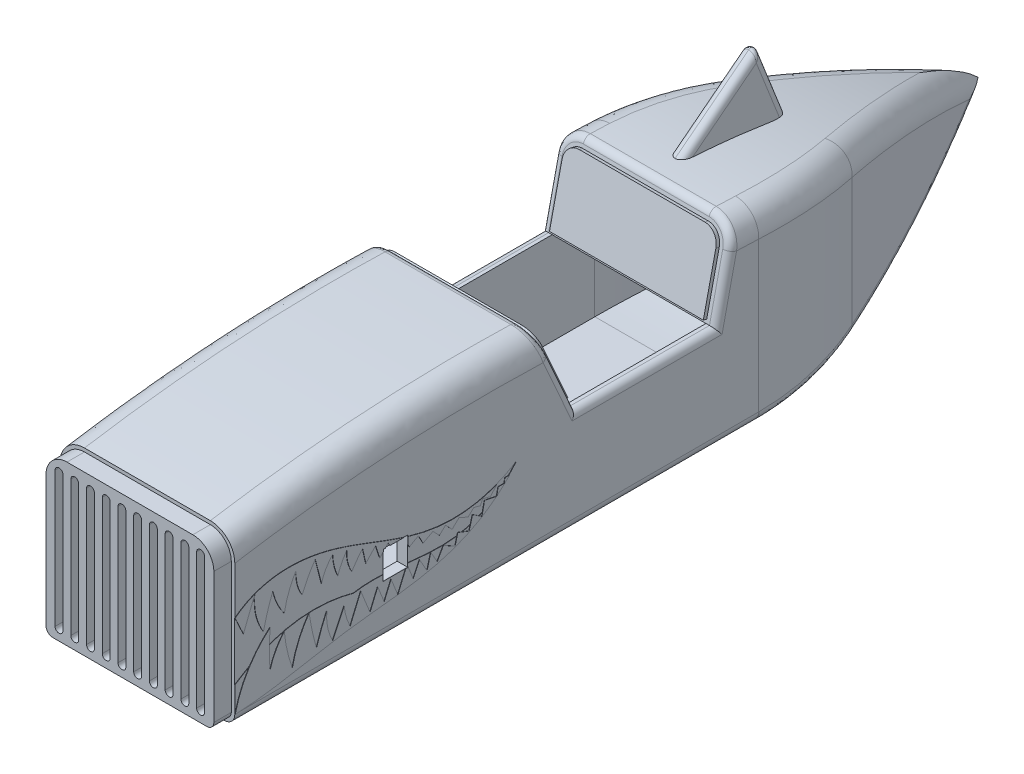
SolidWorks part; units mm, degrees
ref_plane "Front Plane" through (0, 0, 0) normal (0, 0, 1) x (1, 0, 0)
ref_plane "Top Plane" through (0, 0, 0) normal (0, 1, 0) x (1, 0, 0)
ref_plane "Right Plane" through (0, 0, 0) normal (1, 0, 0) x (0, 0, -1)
sketch "Sketch2" plane through (0, 0, 0) normal (1, 0, 0) x (0, 0, -1)
  line L0 (224.917, 170.9722) -> (330.4726, -65.1389)
  line L1 (330.4726, -65.1389) -> (730.4726, -65.1389)
  line L2 (730.4726, -65.1389) -> (783.2504, 170.9722)
  line L4 (330.4726, -359.5834) -> (-647.3052, -359.5834)
  line L5 (-647.3052, -359.5834) -> (-647.3052, 115.4166)
  line L6 (330.4726, -359.5834) -> (852.6948, -359.5834)
  spline S0 degree 2 poles (-647.3052, 115.4166) (-214.8464, 185.17) (224.917, 170.9722) knots 0 0 0 1 1 1
  spline S1 degree 2 poles (783.2504, 170.9722) (1291.8331, 158.9521) (1758.0173, -46.9169) knots 0 0 0 1 1 1
  spline S3 degree 2 poles (852.6948, -359.5834) (1369.0597, -360.7617) (1758.0173, -46.9169) knots 0 0 0 1 1 1
  dimension "D1" = 400
  dimension "D2" = 558.3333
  dimension "D4" = 2405.3225
  dimension "D5" = 475
extrude "Boss-Extrude2" add sketch "Sketch2" along normal blind 250
sketch "Sketch4" plane through (0, 0, 0) normal (0, 1, 0) x (1, 0, 0)
  line L0 (0, 1758.0173) -> (250, 1015.141)
  line L1 (250, 783.2504) -> (250, 1758.0173) construction
  line L2 (250, 1015.141) -> (250, 1758.0173)
  line L3 (250, 1758.0173) -> (0, 1758.0173)
extrude "Cut-Extrude1" cut sketch "Sketch4" against normal through all
sketch "Sketch5" plane through (0, 0, 0) normal (0, -1, 0) x (1, 0, 0)
  line L0 (250, -1015.141) -> (250, -1644.7485)
  line L1 (250, -1644.7485) -> (38.1183, -1644.7485)
  line L2 (38.1183, -1644.7485) -> (250, -1015.141)
extrude "Cut-Extrude2" cut sketch "Sketch5" against normal blind 250
fillet "Fillet3" radius 1000 1 edges at (250, -98.3409, -1015.141)
fillet "Fillet5" radius 30 4 edges at (249.9998, -359.5834, -852.0415) (250, -359.5834, -102.0415) (69.6008, -186.5854, -1551.1982)
fillet "Fillet6" radius 70 4 edges at (143.3389, 98.5671, -1332.0851)
fillet "Fillet7" radius 20 7 edges at (250, 18.0908, -749.0769) (234.1329, 145.4802, -777.5522) (250, 17.3856, -293.5793) (220.44, 157.9137, -230.7549) (90, 170.9722, -783.2504) (250, -65.1389, -530.4726) (90, 170.9722, -224.917)
mirror "Mirror3" about plane through (0, 164.1822, 213.0202) normal (1, 0, 0)
sketch "Sketch7" plane through (0, -158.6117, -709.5787) normal (0, 0.2181, 0.9759) x (1, 0, 0)
  line L8 (-220, 105.7795) -> (220, 105.7795)
  line L9 (220, 105.7795) -> (220, 270.3156)
  line L10 (180, 311.2507) -> (-180, 311.2507)
  line L12 (-220, 105.7795) -> (220, 105.7795)
  line L14 (180, 311.2507) -> (-180, 311.2507)
  line L16 (220, 105.7795) -> (220, 270.3156)
  line L18 (-220, 270.3156) -> (-220, 105.7795)
  line L19 (-220, 270.3156) -> (-220, 105.7795)
  spline S2 degree 3 poles (-2640.4747, -603.4608) (-328.1255, -79.1148) (243.8205, 150.1189) (219.0025, 279.4981) (218.693, 280.7815) (217.9489, 283.3272) (217.5112, 284.5952) (216.0324, 288.2922) (214.8241, 290.6335) (212.68, 293.9614) (211.9101, 295.04) (210.6677, 296.6095) (210.2404, 297.1226) (209.3657, 298.122) (208.9175, 298.6093) (206.6236, 300.9854) (204.619, 302.6934) (201.8963, 304.5814) (201.3409, 304.9466) (200.2077, 305.6516) (199.6318, 305.99) (197.8892, 306.9557) (196.7027, 307.5366) (193.0715, 309.0971) (190.555, 309.8947) (34.6504, 342.1867) (-220.9029, -553.4713) (87.6649, -2654.1669) knots -6.062181 -6.062181 -6.062181 -6.062181 0.125 0.125 0.1875 0.1875 0.25 0.25 0.375 0.375 0.4375 0.4375 0.46875 0.46875 0.5 0.5 0.625 0.625 0.65625 0.65625 0.6875 0.6875 0.75 0.75 0.875 0.875 8.196114 8.196114 8.196114 8.196114 only from (220, 270.3156) to (180, 311.2507)
  spline S3 degree 3 poles (220, 270.3156) (220, 272.9875) (219.7471, 275.6165) (219.0025, 279.4981) (218.693, 280.7815) (217.9489, 283.3272) (217.5112, 284.5952) (216.0324, 288.2922) (214.8241, 290.6335) (212.68, 293.9614) (211.9101, 295.04) (210.6677, 296.6095) (210.2404, 297.1226) (209.3657, 298.122) (208.9175, 298.6093) (206.6236, 300.9854) (204.619, 302.6934) (201.8963, 304.5814) (201.3409, 304.9466) (200.2077, 305.6516) (199.6318, 305.99) (197.8892, 306.9557) (196.7027, 307.5366) (193.0715, 309.0971) (190.555, 309.8947) (185.3205, 310.9789) (182.6735, 311.2507) (180, 311.2507) knots 0 0 0 0 0.125 0.125 0.1875 0.1875 0.25 0.25 0.375 0.375 0.4375 0.4375 0.46875 0.46875 0.5 0.5 0.625 0.625 0.65625 0.65625 0.6875 0.6875 0.75 0.75 0.875 0.875 1 1 1 1
  spline S4 degree 3 poles (678.813, -2554.5124) (152.6875, -212.48) (-66.5797, 335.3845) (-189.1712, 310.1833) (-190.4508, 309.8526) (-192.3532, 309.2562) (-192.9863, 309.04) (-194.236, 308.5773) (-194.8526, 308.331) (-197.8952, 307.0265) (-200.2008, 305.7509) (-202.9242, 303.8701) (-203.4608, 303.4794) (-204.5179, 302.6688) (-205.0385, 302.2486) (-206.5586, 300.9578) (-207.5227, 300.0528) (-210.2718, 297.209) (-211.9147, 295.1422) (-214.0878, 291.7796) (-214.7537, 290.6292) (-215.9666, 288.2822) (-216.5146, 287.0837) (-217.4954, 284.6377) (-217.9282, 283.3901) (-218.6767, 280.8449) (-218.9928, 279.5428) (-248.1541, 128.1782) (549.5825, -120.8625) (2661.3254, -527.2403) knots -5.748054 -5.748054 -5.748054 -5.748054 0.125 0.125 0.1875 0.1875 0.21875 0.21875 0.25 0.25 0.375 0.375 0.40625 0.40625 0.4375 0.4375 0.5 0.5 0.625 0.625 0.6875 0.6875 0.75 0.75 0.8125 0.8125 0.875 0.875 8.060154 8.060154 8.060154 8.060154 only from (-180, 311.2507) to (-220, 270.3156)
  spline S5 degree 3 poles (-180, 311.2507) (-182.6725, 311.2507) (-185.2986, 310.9794) (-189.1712, 310.1833) (-190.4508, 309.8526) (-192.3532, 309.2562) (-192.9863, 309.04) (-194.236, 308.5773) (-194.8526, 308.331) (-197.8952, 307.0265) (-200.2008, 305.7509) (-202.9242, 303.8701) (-203.4608, 303.4794) (-204.5179, 302.6688) (-205.0385, 302.2486) (-206.5586, 300.9578) (-207.5227, 300.0528) (-210.2718, 297.209) (-211.9147, 295.1422) (-214.0878, 291.7796) (-214.7537, 290.6292) (-215.9666, 288.2822) (-216.5146, 287.0837) (-217.4954, 284.6377) (-217.9282, 283.3901) (-218.6767, 280.8449) (-218.9928, 279.5428) (-219.7472, 275.6269) (-220, 272.9864) (-220, 270.3156) knots 0 0 0 0 0.125 0.125 0.1875 0.1875 0.21875 0.21875 0.25 0.25 0.375 0.375 0.40625 0.40625 0.4375 0.4375 0.5 0.5 0.625 0.625 0.6875 0.6875 0.75 0.75 0.8125 0.8125 0.875 0.875 1 1 1 1
  dimension "D1" = 10
extrude "Boss-Extrude4" add sketch "Sketch7" along normal blind 10
sketch "Sketch8" plane through (0, 112.2812, -251.1554) normal (0, 0.4081, -0.9129) x (-1, 0, 0)
  line L8 (180, 41.7574) -> (-180, 41.7574)
  line L9 (-220, -184.3428) -> (220, -184.3428)
  line L10 (180, 41.7574) -> (-180, 41.7574)
  line L13 (-220, -184.3428) -> (220, -184.3428)
  line L16 (-220, -3.8239) -> (-220, -184.3428)
  line L19 (-220, -3.8239) -> (-220, -184.3428)
  line L21 (220, -184.3428) -> (220, -3.8239)
  line L22 (220, -184.3428) -> (220, -3.8239)
  spline S2 degree 3 poles (658.475, -2831.11) (125.9019, -437.1888) (-77.5317, 67.6508) (-188.9994, 40.5934) (-189.6751, 40.4085) (-191.0193, 39.9979) (-191.6897, 39.7715) (-193.6763, 39.035) (-194.9606, 38.4714) (-197.4549, 37.2096) (-198.6646, 36.5109) (-200.4247, 35.3641) (-201.0023, 34.9653) (-202.1392, 34.1348) (-202.6999, 33.7018) (-205.4321, 31.4771) (-207.4044, 29.4957) (-209.6284, 26.7909) (-210.061, 26.2385) (-210.9019, 25.1106) (-211.3111, 24.5337) (-212.4939, 22.7813) (-213.2231, 21.5839) (-215.2438, 17.9098) (-216.3684, 15.351) (-217.5059, 12.0209) (-217.7201, 11.3472) (-218.1181, 9.9975) (-218.3024, 9.3203) (-218.8118, 7.2822) (-219.0937, 5.9145) (-244.4109, -148.3056) (419.4022, -407.5616) (2628.9152, -905.5755) knots -4.972818 -4.972818 -4.972818 -4.972818 0.125 0.125 0.15625 0.15625 0.1875 0.1875 0.25 0.25 0.3125 0.3125 0.34375 0.34375 0.375 0.375 0.5 0.5 0.53125 0.53125 0.5625 0.5625 0.625 0.625 0.75 0.75 0.78125 0.78125 0.8125 0.8125 0.875 0.875 7.815868 7.815868 7.815868 7.815868 only from (-180, 41.7574) to (-220, -3.8239)
  spline S3 degree 3 poles (-180, 41.7574) (-182.8315, 41.7574) (-185.6037, 41.4177) (-188.9994, 40.5934) (-189.6751, 40.4085) (-191.0193, 39.9979) (-191.6897, 39.7715) (-193.6763, 39.035) (-194.9606, 38.4714) (-197.4549, 37.2096) (-198.6646, 36.5109) (-200.4247, 35.3641) (-201.0023, 34.9653) (-202.1392, 34.1348) (-202.6999, 33.7018) (-205.4321, 31.4771) (-207.4044, 29.4957) (-209.6284, 26.7909) (-210.061, 26.2385) (-210.9019, 25.1106) (-211.3111, 24.5337) (-212.4939, 22.7813) (-213.2231, 21.5839) (-215.2438, 17.9098) (-216.3684, 15.351) (-217.5059, 12.0209) (-217.7201, 11.3472) (-218.1181, 9.9975) (-218.3024, 9.3203) (-218.8118, 7.2822) (-219.0937, 5.9145) (-219.7716, 1.7856) (-220, -1.0015) (-220, -3.8239) knots 0 0 0 0 0.125 0.125 0.15625 0.15625 0.1875 0.1875 0.25 0.25 0.3125 0.3125 0.34375 0.34375 0.375 0.375 0.5 0.5 0.53125 0.53125 0.5625 0.5625 0.625 0.625 0.75 0.75 0.78125 0.78125 0.8125 0.8125 0.875 0.875 1 1 1 1
  spline S4 degree 3 poles (-2618.3523, -940.1974) (-348.6278, -392.9246) (243.0907, -140.1753) (218.8672, 7.2928) (218.194, 10.0036) (217.0556, 13.3399) (216.8124, 14.0058) (216.3004, 15.3195) (216.0312, 15.9685) (215.1836, 17.8922) (214.5655, 19.1434) (212.5521, 22.8033) (210.9993, 25.1192) (208.7654, 27.8416) (208.3024, 28.379) (207.3536, 29.427) (206.8684, 29.9371) (205.3804, 31.4252) (204.3451, 32.3611) (201.1087, 34.9997) (198.7788, 36.5356) (195.6216, 38.1381) (194.9794, 38.4416) (193.6885, 39.0076) (193.0376, 39.2711) (191.0688, 40.0029) (189.7346, 40.4125) (187.0231, 41.0755) (185.6456, 41.3286) (183.5453, 41.5847) (182.8378, 41.6495) (14.1774, 51.9173) (-201.3243, -1150.6337) (-437.6769, -2884.9894) knots -6.454036 -6.454036 -6.454036 -6.454036 0.125 0.125 0.25 0.25 0.28125 0.28125 0.3125 0.3125 0.375 0.375 0.5 0.5 0.53125 0.53125 0.5625 0.5625 0.625 0.625 0.75 0.75 0.78125 0.78125 0.8125 0.8125 0.875 0.875 0.9375 0.9375 0.96875 0.96875 8.373292 8.373292 8.373292 8.373292 only from (220, -3.8239) to (180, 41.7574)
  spline S5 degree 3 poles (220, -3.8239) (220, -0.995) (219.7705, 1.7936) (218.8672, 7.2928) (218.194, 10.0036) (217.0556, 13.3399) (216.8124, 14.0058) (216.3004, 15.3195) (216.0312, 15.9685) (215.1836, 17.8922) (214.5655, 19.1434) (212.5521, 22.8033) (210.9993, 25.1192) (208.7654, 27.8416) (208.3024, 28.379) (207.3536, 29.427) (206.8684, 29.9371) (205.3804, 31.4252) (204.3451, 32.3611) (201.1087, 34.9997) (198.7788, 36.5356) (195.6216, 38.1381) (194.9794, 38.4416) (193.6885, 39.0076) (193.0376, 39.2711) (191.0688, 40.0029) (189.7346, 40.4125) (187.0231, 41.0755) (185.6456, 41.3286) (183.5453, 41.5847) (182.8378, 41.6495) (181.4202, 41.7358) (180.7105, 41.7574) (180, 41.7574) knots 0 0 0 0 0.125 0.125 0.25 0.25 0.28125 0.28125 0.3125 0.3125 0.375 0.375 0.5 0.5 0.53125 0.53125 0.5625 0.5625 0.625 0.625 0.75 0.75 0.78125 0.78125 0.8125 0.8125 0.875 0.875 0.9375 0.9375 0.96875 0.96875 1 1 1 1
  dimension "D1" = 10
extrude "Boss-Extrude5" add sketch "Sketch8" along normal blind 10
sketch "Sketch9" plane through (0, 0, 647.3052) normal (0, 0, 1) x (1, 0, 0)
  line L8 (240, -329.5834) -> (240, 44.5119)
  line L9 (180, 105.4166) -> (-180, 105.4166)
  line L10 (-240, 44.5119) -> (-240, -329.5834)
  line L11 (-220, -349.5834) -> (220, -349.5834)
  line L12 (240, -329.5834) -> (240, 44.5119)
  line L13 (180, 105.4166) -> (-180, 105.4166)
  line L15 (-220, -349.5834) -> (220, -349.5834)
  line L17 (-240, 44.5119) -> (-240, -329.5834)
  arc A4 (-240, -329.5834) -> (-220, -349.5834) centre (-220, -329.5834) ccw
  arc A5 (220, -349.5834) -> (240, -329.5834) centre (220, -329.5834) ccw
  arc A7 (220, -349.5834) -> (240, -329.5834) centre (220, -329.5834) ccw
  arc A8 (-240, -329.5834) -> (-220, -349.5834) centre (-220, -329.5834) ccw
  spline S4 degree 3 poles (-2587.6929, -916.8717) (-323.2181, -367.9419) (269.7798, -102.8503) (238.4914, 58.2251) (238.0236, 60.1413) (236.8984, 63.9415) (236.2372, 65.8331) (234.0055, 71.3434) (232.183, 74.8313) (228.9506, 79.7868) (227.7895, 81.3922) (225.2932, 84.5066) (223.9784, 85.9901) (219.8433, 90.2221) (216.833, 92.7562) (212.7454, 95.5562) (211.9112, 96.0979) (210.2105, 97.1425) (209.3507, 97.6413) (206.7436, 99.0686) (204.9687, 99.9282) (201.3465, 101.4665) (199.4992, 102.1453) (196.6733, 103.0263) (195.7221, 103.297) (193.8012, 103.792) (192.8297, 104.0165) (3.2628, 142.7945) (-283.0904, -747.3571) (-686.7094, -2751.5032) knots -5.023534 -5.023534 -5.023534 -5.023534 0.125 0.125 0.1875 0.1875 0.25 0.25 0.375 0.375 0.4375 0.4375 0.5 0.5 0.625 0.625 0.65625 0.65625 0.6875 0.6875 0.75 0.75 0.8125 0.8125 0.84375 0.84375 0.875 0.875 6.905956 6.905956 6.905956 6.905956 only from (240, 44.5119) to (180, 105.4166)
  spline S5 degree 3 poles (240, 44.5119) (240, 48.5032) (239.6172, 52.4294) (238.4914, 58.2251) (238.0236, 60.1413) (236.8984, 63.9415) (236.2372, 65.8331) (234.0055, 71.3434) (232.183, 74.8313) (228.9506, 79.7868) (227.7895, 81.3922) (225.2932, 84.5066) (223.9784, 85.9901) (219.8433, 90.2221) (216.833, 92.7562) (212.7454, 95.5562) (211.9112, 96.0979) (210.2105, 97.1425) (209.3507, 97.6413) (206.7436, 99.0686) (204.9687, 99.9282) (201.3465, 101.4665) (199.4992, 102.1453) (196.6733, 103.0263) (195.7221, 103.297) (193.8012, 103.792) (192.8297, 104.0165) (187.9437, 105.016) (183.993, 105.4166) (180, 105.4166) knots 0 0 0 0 0.125 0.125 0.1875 0.1875 0.25 0.25 0.375 0.375 0.4375 0.4375 0.5 0.5 0.625 0.625 0.65625 0.65625 0.6875 0.6875 0.75 0.75 0.8125 0.8125 0.84375 0.84375 0.875 0.875 1 1 1 1
  spline S6 degree 3 poles (770.8449, -2726.5077) (221.732, -446.6995) (-37.4289, 135.5885) (-193.7031, 103.8405) (-195.6157, 103.3521) (-198.4593, 102.4713) (-199.4054, 102.152) (-201.276, 101.4678) (-202.1991, 101.1035) (-206.7542, 99.1736) (-210.2077, 97.2857) (-214.2892, 94.5007) (-215.0937, 93.9225) (-216.6786, 92.7224) (-217.4604, 92.0991) (-219.7449, 90.1827) (-221.1934, 88.8384) (-225.3262, 84.6145) (-227.7973, 81.5437) (-230.5226, 77.3793) (-231.049, 76.5306) (-232.0538, 74.8188) (-232.5337, 73.9534) (-233.9067, 71.3291) (-234.7331, 69.5422) (-236.2137, 65.8958) (-236.867, 64.036) (-237.7146, 61.1906) (-237.975, 60.2328) (-238.4509, 58.2983) (-238.6655, 57.324) (-274.978, -128.714) (541.4501, -413.2364) (2609.7686, -843.8058) knots -4.875561 -4.875561 -4.875561 -4.875561 0.125 0.125 0.1875 0.1875 0.21875 0.21875 0.25 0.25 0.375 0.375 0.40625 0.40625 0.4375 0.4375 0.5 0.5 0.625 0.625 0.65625 0.65625 0.6875 0.6875 0.75 0.75 0.8125 0.8125 0.84375 0.84375 0.875 0.875 6.804612 6.804612 6.804612 6.804612 only from (-180, 105.4166) to (-240, 44.5119)
  spline S7 degree 3 poles (-180, 105.4166) (-183.9921, 105.4166) (-187.9158, 105.0163) (-193.7031, 103.8405) (-195.6157, 103.3521) (-198.4593, 102.4713) (-199.4054, 102.152) (-201.276, 101.4678) (-202.1991, 101.1035) (-206.7542, 99.1736) (-210.2077, 97.2857) (-214.2892, 94.5007) (-215.0937, 93.9225) (-216.6786, 92.7224) (-217.4604, 92.0991) (-219.7449, 90.1827) (-221.1934, 88.8384) (-225.3262, 84.6145) (-227.7973, 81.5437) (-230.5226, 77.3793) (-231.049, 76.5306) (-232.0538, 74.8188) (-232.5337, 73.9534) (-233.9067, 71.3291) (-234.7331, 69.5422) (-236.2137, 65.8958) (-236.867, 64.036) (-237.7146, 61.1906) (-237.975, 60.2328) (-238.4509, 58.2983) (-238.6655, 57.324) (-239.6174, 52.4474) (-240, 48.502) (-240, 44.5119) knots 0 0 0 0 0.125 0.125 0.1875 0.1875 0.21875 0.21875 0.25 0.25 0.375 0.375 0.40625 0.40625 0.4375 0.4375 0.5 0.5 0.625 0.625 0.65625 0.65625 0.6875 0.6875 0.75 0.75 0.8125 0.8125 0.84375 0.84375 0.875 0.875 1 1 1 1
  dimension "D1" = 10
extrude "Boss-Extrude6" add sketch "Sketch9" along normal blind 50
shell "Shell1" thickness 30
sketch "Sketch11" plane through (0, 0, 697.3052) normal (0, 0, 1) x (1, 0, 0)
  line L0 (-240, -329.5834) -> (240, -329.5834) construction
  line L1 (-224.9268, 84.881) -> (224.9262, 84.881) construction
  line L2 (-224.9268, 84.881) -> (-224.9268, -329.5834) construction
  line L3 (224.9262, 84.881) -> (224.9262, -329.5834) construction
  line L4 (-214.0984, 68.5873) -> (-214.0984, -318.7083)
  line L5 (-191.5971, 68.5873) -> (-191.5971, -318.7083)
  line L6 (-146.5971, 68.5873) -> (-146.5971, -318.7083)
  line L7 (-169.0984, 68.5873) -> (-169.0984, -318.7083)
  line L8 (-101.5971, 68.5873) -> (-101.5971, -318.7083)
  line L9 (-124.0984, 68.5873) -> (-124.0984, -318.7083)
  line L10 (-56.5971, 68.5873) -> (-56.5971, -318.7083)
  line L11 (-79.0984, 68.5873) -> (-79.0984, -318.7083)
  line L12 (-11.5971, 68.5873) -> (-11.5971, -318.7083)
  line L13 (-34.0984, 68.5873) -> (-34.0984, -318.7083)
  line L14 (33.4029, 68.5873) -> (33.4029, -318.7083)
  line L15 (10.9016, 68.5873) -> (10.9016, -318.7083)
  line L16 (78.4029, 68.5873) -> (78.4029, -318.7083)
  line L17 (55.9016, 68.5873) -> (55.9016, -318.7083)
  line L18 (123.4029, 68.5873) -> (123.4029, -318.7083)
  line L19 (100.9016, 68.5873) -> (100.9016, -318.7083)
  line L20 (168.4029, 68.5873) -> (168.4029, -318.7083)
  line L21 (145.9016, 68.5873) -> (145.9016, -318.7083)
  line L22 (213.4029, 68.5873) -> (213.4029, -318.7083)
  line L23 (190.9016, 68.5873) -> (190.9016, -318.7083)
  arc A0 (-214.0984, 68.5873) -> (-191.5971, 68.5873) centre (-202.8477, 68.5873) cw
  arc A1 (-214.0984, -318.7083) -> (-191.5971, -318.7083) centre (-202.8477, -318.7083) ccw
  arc A2 (-169.0984, -318.7083) -> (-146.5971, -318.7083) centre (-157.8477, -318.7083) ccw
  arc A3 (-169.0984, 68.5873) -> (-146.5971, 68.5873) centre (-157.8477, 68.5873) cw
  arc A4 (-124.0984, -318.7083) -> (-101.5971, -318.7083) centre (-112.8477, -318.7083) ccw
  arc A5 (-124.0984, 68.5873) -> (-101.5971, 68.5873) centre (-112.8477, 68.5873) cw
  arc A6 (-79.0984, -318.7083) -> (-56.5971, -318.7083) centre (-67.8477, -318.7083) ccw
  arc A7 (-79.0984, 68.5873) -> (-56.5971, 68.5873) centre (-67.8477, 68.5873) cw
  arc A8 (-34.0984, -318.7083) -> (-11.5971, -318.7083) centre (-22.8477, -318.7083) ccw
  arc A9 (-34.0984, 68.5873) -> (-11.5971, 68.5873) centre (-22.8477, 68.5873) cw
  arc A10 (10.9016, -318.7083) -> (33.4029, -318.7083) centre (22.1523, -318.7083) ccw
  arc A11 (10.9016, 68.5873) -> (33.4029, 68.5873) centre (22.1523, 68.5873) cw
  arc A12 (55.9016, -318.7083) -> (78.4029, -318.7083) centre (67.1523, -318.7083) ccw
  arc A13 (55.9016, 68.5873) -> (78.4029, 68.5873) centre (67.1523, 68.5873) cw
  arc A14 (100.9016, -318.7083) -> (123.4029, -318.7083) centre (112.1523, -318.7083) ccw
  arc A15 (100.9016, 68.5873) -> (123.4029, 68.5873) centre (112.1523, 68.5873) cw
  arc A16 (145.9016, -318.7083) -> (168.4029, -318.7083) centre (157.1523, -318.7083) ccw
  arc A17 (145.9016, 68.5873) -> (168.4029, 68.5873) centre (157.1523, 68.5873) cw
  arc A18 (190.9016, -318.7083) -> (213.4029, -318.7083) centre (202.1523, -318.7083) ccw
  arc A19 (190.9016, 68.5873) -> (213.4029, 68.5873) centre (202.1523, 68.5873) cw
  spline S0 degree 3 poles (-180, 105.4166) (-183.9921, 105.4166) (-187.9158, 105.0163) (-193.7031, 103.8405) (-195.6157, 103.3521) (-198.4593, 102.4713) (-199.4054, 102.152) (-201.276, 101.4678) (-202.1991, 101.1035) (-206.7542, 99.1736) (-210.2077, 97.2857) (-214.2892, 94.5007) (-215.0937, 93.9225) (-216.6786, 92.7224) (-217.4604, 92.0991) (-219.7449, 90.1827) (-221.1934, 88.8384) (-225.3262, 84.6145) (-227.7973, 81.5437) (-230.5226, 77.3793) (-231.049, 76.5306) (-232.0538, 74.8188) (-232.5337, 73.9534) (-233.9067, 71.3291) (-234.7331, 69.5422) (-236.2137, 65.8958) (-236.867, 64.036) (-237.7146, 61.1906) (-237.975, 60.2328) (-238.4509, 58.2983) (-238.6655, 57.324) (-239.6174, 52.4474) (-240, 48.502) (-240, 44.5119) knots 0 0 0 0 0.125 0.125 0.1875 0.1875 0.21875 0.21875 0.25 0.25 0.375 0.375 0.40625 0.40625 0.4375 0.4375 0.5 0.5 0.625 0.625 0.65625 0.65625 0.6875 0.6875 0.75 0.75 0.8125 0.8125 0.84375 0.84375 0.875 0.875 1 1 1 1 construction
  spline S1 degree 3 poles (240, 44.5119) (240, 48.5032) (239.6172, 52.4294) (238.4914, 58.2251) (238.0236, 60.1413) (236.8984, 63.9415) (236.2372, 65.8331) (234.0055, 71.3434) (232.183, 74.8313) (228.9506, 79.7868) (227.7895, 81.3922) (225.2932, 84.5066) (223.9784, 85.9901) (219.8433, 90.2221) (216.833, 92.7562) (212.7454, 95.5562) (211.9112, 96.0979) (210.2105, 97.1425) (209.3507, 97.6413) (206.7436, 99.0686) (204.9687, 99.9282) (201.3465, 101.4665) (199.4992, 102.1453) (196.6733, 103.0263) (195.7221, 103.297) (193.8012, 103.792) (192.8297, 104.0165) (187.9437, 105.016) (183.993, 105.4166) (180, 105.4166) knots 0 0 0 0 0.125 0.125 0.1875 0.1875 0.25 0.25 0.375 0.375 0.4375 0.4375 0.5 0.5 0.625 0.625 0.65625 0.65625 0.6875 0.6875 0.75 0.75 0.8125 0.8125 0.84375 0.84375 0.875 0.875 1 1 1 1 construction
  dimension "D1" = 449.8531
  dimension "D2" = 10
extrude "Cut-Extrude3" cut sketch "Sketch11" against normal blind 50
ref_plane "Plane2" through (0, 140, 0) normal (0, 1, 0) x (1, 0, 0)
sketch "Sketch13" plane through (0, 140, 0) normal (0, 1, 0) x (1, 0, 0)
  line L0 (0, 862.1367) -> (20, 862.1367)
  line L1 (0, 862.1367) -> (-20, 862.1367)
  line L2 (20, 862.1367) -> (20, 1162.1367)
  line L3 (20, 1162.1367) -> (-20, 1162.1367)
  line L4 (-20, 1162.1367) -> (-20, 862.1367)
  dimension "D1" = 20
  dimension "D2" = 20
  dimension "D3" = 300
extrude "Boss-Extrude8" add sketch "Sketch13" along normal blind 200
sketch "Sketch14" plane through (-20, 0, 0) normal (-1, 0, 0) x (0, 0, 1)
  line L0 (-1083.3262, 340) -> (-862.1367, 167.9281)
  line L1 (-1162.1367, 340) -> (-862.1367, 340) construction
  line L2 (-1083.3262, 340) -> (-1162.1367, 140)
  line L3 (-1162.1367, 340) -> (-1162.1367, 140) construction
  line L4 (-1162.1367, 140) -> (-1126.6478, 140)
  line L5 (-1162.1367, 140) -> (-1162.1367, 340)
  line L6 (-1162.1367, 340) -> (-1083.3262, 340)
  line L7 (-1083.3262, 340) -> (-862.1367, 340)
  line L8 (-1083.3262, 340) -> (-862.1367, 340)
  line L9 (-862.1367, 167.9281) -> (-1083.3262, 340)
extrude "Cut-Extrude4" cut sketch "Sketch14" against normal blind 200
sketch "Sketch15" plane through (-20, 0, 0) normal (-1, 0, 0) x (0, 0, 1)
  line L0 (-1162.1367, 140) -> (-1083.3262, 340)
  line L1 (-1083.3262, 340) -> (-1162.1367, 340)
  line L2 (-1162.1367, 340) -> (-1162.1367, 140)
extrude "Cut-Extrude5" cut sketch "Sketch15" against normal blind 200
fillet "Fillet9" radius 20 4 edges at (-20, 240, -1122.7314) (-20, 253.9641, -972.7314) (20, 240, -1122.7314)
fillet "Fillet10" radius 10 2 edges at (-14.1421, 330.5707, -1080.7456) (14.1421, 330.5707, -1080.7456)
sketch "Sketch16" plane through (250, 0, 0) normal (1, 0, 0) x (0, 0, -1)
  line L0 (-647.3052, 44.5119) -> (-647.3052, -329.5834) construction
  line L1 (-647.3052, -90.8998) -> (-647.3052, -329.5834)
  spline S0 degree 3 poles (-647.3051, -329.5834) (-536.9852, -325.359) (-263.7535, -251.5377) (24.0143, -267.7208) (158.1822, -105.5988) knots 0 0 0 0 0.390094 1 1 1 1
  spline S1 degree 2 poles (-647.3052, -329.5834) (-647.3051, -329.5834) (-647.3051, -329.5834) knots 0 0 0 0 0 0
  spline S3 degree 3 poles (-647.3052, -90.8998) (-581.2901, -40.1904) (-292.6231, -21.5629) (-62.616, -236.961) (158.1822, -105.5988) knots 0 0 0 0 0.283124 1 1 1 1
extrude "Cut-Extrude6" cut sketch "Sketch16" against normal blind 1
ref_plane "Plane3" through (250, 0, 0) normal (1, 0, 0) x (0, 0, -1)
sketch "Sketch17" plane through (250, 0, 0) normal (1, 0, 0) x (0, 0, -1)
  line L0 (-647.3052, -329.5834) -> (-647.3052, 44.5119) construction
  line L1 (-647.3052, -257.068) -> (-647.3052, -329.5834)
  line L2 (97.2869, -162.3007) -> (97.6813, -162.8066)
  spline S0 degree 3 poles (-647.3052, -329.5834) (-546.3367, -326.0965) (-272.7667, -253.8784) (14.7758, -268.2625) (158.1822, -105.5988) knots 0 0 0 0 0.357577 1 1 1 1
  spline S1 degree 3 poles (-647.3051, -329.5834) (-536.9852, -325.359) (-263.7535, -251.5377) (24.0143, -267.7208) (158.1822, -105.5988) knots 0 0 0 0 0.390094 1 1 1 1 construction
  spline S2 degree 3 poles (-647.3047, -329.5834) (-536.9849, -325.3589) (-263.7534, -251.5377) (24.0143, -267.7208) (158.1822, -105.5988) knots 0 0 0 0 0.390094 1 1 1 1 construction
  spline S3 degree 2 poles (-647.3052, -257.068) (-487.6267, -149.8999) (-307.5423, -199.3024) knots 0 0 0 1 1 1
  spline S4 degree 3 poles (-307.5423, -199.3024) (-167.7888, -175.3219) (-22.633, -260.6794) (112.1165, -151.0354) knots 0 0 0 0 1 1 1 1
extrude "Boss-Extrude22" add sketch "Sketch17" against normal up to surface (1 mm away) separate body contours S4 S3 L1 S0 L2
ref_plane "Plane5" through (251, 0, 0) normal (1, 0, 0) x (0, 0, -1)
sketch "Sketch18" plane through (251, 0, 0) normal (1, 0, 0) x (0, 0, -1)
  line L0 (-368.1803, -285.4583) -> (-335.6608, -217.2098)
  line L1 (-318.2718, -275.1837) -> (-287.9404, -203.6199)
  line L2 (-287.9404, -203.6199) -> (-261.4231, -269.1505)
  line L3 (-261.4231, -269.1505) -> (-239.4087, -217.2098)
  line L4 (-239.4087, -217.2098) -> (-220.8089, -263.1745)
  line L5 (-220.8089, -263.1745) -> (-201.3274, -217.2098)
  line L6 (-201.3274, -217.2098) -> (-181.8251, -265.4045)
  line L7 (-181.8251, -265.4045) -> (-155.6385, -203.6199)
  line L8 (-155.6385, -203.6199) -> (-137.8395, -247.6055)
  line L9 (137.6938, -128.7148) -> (124.2508, -128.7148)
  line L10 (124.2508, -128.7148) -> (122.682, -141.8256)
  line L11 (122.682, -141.8256) -> (105.1931, -141.8256)
  line L12 (105.1931, -141.8256) -> (100.8234, -163.0815)
  line L13 (100.8234, -163.0815) -> (66.0439, -155.9318)
  line L14 (66.0439, -155.9318) -> (58.6945, -191.6827)
  line L15 (58.6945, -191.6827) -> (31.8145, -173.8072)
  line L16 (31.8145, -173.8072) -> (22.0697, -209.8225)
  line L17 (-137.8395, -247.6055) -> (-119.8364, -209.8225)
  line L18 (-119.8364, -209.8225) -> (-98.322, -247.6055)
  line L19 (-98.322, -247.6055) -> (-87.5478, -207.7857)
  line L20 (-87.5478, -207.7857) -> (-69.1556, -239.8228)
  line L21 (-69.1556, -239.8228) -> (-51.6025, -208.4478)
  line L22 (-51.6025, -208.4478) -> (-18.2788, -227.0912)
  line L23 (-18.2788, -227.0912) -> (-10.1732, -197.1345)
  line L24 (-10.1732, -197.1345) -> (22.0697, -209.8225)
  line L25 (-647.3052, -90.8998) -> (-623.4533, -141.8256)
  line L26 (-623.4533, -141.8256) -> (-590.9814, -59.3075)
  line L27 (-417.9142, -59.3075) -> (-400.2338, -128.7148)
  line L28 (-282.5955, -100.5665) -> (-273.4854, -141.8256)
  line L29 (-273.4854, -141.8256) -> (-245.5479, -112.1458)
  line L30 (-245.5479, -112.1458) -> (-233.4012, -148.9092)
  line L31 (-233.4012, -148.9092) -> (-209.3954, -123.4063)
  line L32 (-209.3954, -123.4063) -> (-191.6351, -155.9318)
  line L33 (-191.6351, -155.9318) -> (-161.8521, -139.6691)
  line L34 (-161.8521, -139.6691) -> (-149.0679, -163.0815)
  line L35 (-149.0679, -163.0815) -> (-123.1131, -148.9092)
  line L36 (-123.1131, -148.9092) -> (-109.5178, -173.8072)
  line L37 (-109.5178, -173.8072) -> (-81.5926, -158.559)
  line L38 (-81.5926, -158.559) -> (-62.7647, -177.9656)
  line L39 (-62.7647, -177.9656) -> (-45.6468, -161.3582)
  line L40 (-45.6468, -161.3582) -> (-26.5918, -180.9989)
  line L41 (-26.5918, -180.9989) -> (-6.3474, -161.3582)
  line L42 (-6.3474, -161.3582) -> (18.9259, -173.8072)
  line L43 (18.9259, -173.8072) -> (35.2539, -157.9661)
  line L44 (35.2539, -157.9661) -> (54.0528, -163.0815)
  line L45 (54.0528, -163.0815) -> (61.0338, -148.9092)
  line L46 (61.0338, -148.9092) -> (82.9798, -154.8809)
  line L47 (82.9798, -154.8809) -> (100.8234, -134.0385)
  parabola Q0 construction
  parabola Q1 construction
  spline S0 degree 2 poles (-647.3052, -329.5834) (-623.3048, -229.7245) (-547.4569, -164.2507) knots 0 0 0 1 1 1
  spline S1 degree 2 poles (-547.4569, -164.2507) (-551.8802, -216.753) (-547.4569, -269.1505) knots 0 0 0 1 1 1
  spline S2 degree 2 poles (-547.4569, -269.1505) (-535.1769, -226.9869) (-506.6531, -193.9587) knots 0 0 0 1 1 1
  spline S3 degree 2 poles (-506.6531, -193.9587) (-501.9034, -246.5638) (-483.5846, -295.39) knots 0 0 0 1 1 1
  spline S4 degree 2 poles (-483.5846, -295.39) (-470.7943, -234.4549) (-435.7489, -184.074) knots 0 0 0 1 1 1
  spline S5 degree 2 poles (-435.7489, -184.074) (-428.4536, -233.3878) (-414.5465, -281.0772) knots 0 0 0 1 1 1
  spline S6 degree 2 poles (-414.5465, -281.0772) (-402.2324, -241.4234) (-385.0791, -203.6199) knots 0 0 0 1 1 1
  spline S7 degree 2 poles (-385.0791, -203.6199) (-388.5129, -248.3777) (-368.1803, -285.4583) knots 0 0 0 1 1 1
  spline S8 degree 2 poles (-335.6608, -217.2098) (-331.8873, -247.7422) (-318.2718, -275.1837) knots 0 0 0 1 1 1
  spline S9 degree 3 poles (-647.3047, -329.5834) (-536.9849, -325.3589) (-263.7534, -251.5377) (24.0143, -267.7208) (158.1822, -105.5988) knots 0 0 0 0 0.390094 1 1 1 1 construction
  spline S10 degree 3 poles (-647.3051, -329.5834) (-536.9852, -325.359) (-263.7535, -251.5377) (24.0143, -267.7208) (158.1822, -105.5988) knots 0 0 0 0 0.390094 1 1 1 1 construction
  spline S11 degree 3 poles (-647.3052, -329.5834) (-546.3367, -326.0965) (-296.5987, -260.1697) (-35.2165, -266.4136) (97.6813, -162.8066) knots 0 0 0 0 0.357577 0.912885 0.912885 0.912885 0.912885 construction
  spline S12 degree 3 poles (-307.5423, -199.3024) (-172.9014, -176.1992) (-33.2463, -254.5805) (97.2869, -162.3007) knots 0 0 0 0 0.963417 0.963417 0.963417 0.963417 construction
  spline S13 degree 3 poles (158.1822, -105.5988) (-62.616, -236.961) (-292.6231, -21.5629) (-581.2901, -40.1904) (-647.3052, -90.8998) knots 0 0 0 0 0.716876 1 1 1 1 construction
  spline S14 degree 2 poles (-590.9814, -59.3075) (-595.9919, -116.6719) (-566.466, -164.2507) knots 0 0 0 1 1 1
  spline S15 degree 2 poles (-566.466, -164.2507) (-556.1227, -120.1304) (-539.5566, -77.9034) knots 0 0 0 1 1 1
  spline S16 degree 2 poles (-539.5566, -77.9034) (-530.4727, -117.1934) (-506.6531, -148.9092) knots 0 0 0 1 1 1
  spline S17 degree 2 poles (-506.6531, -148.9092) (-498.3226, -101.0262) (-472.6795, -59.3075) knots 0 0 0 1 1 1
  spline S18 degree 2 poles (-472.6795, -59.3075) (-475.2434, -96.9623) (-455.801, -128.7148) knots 0 0 0 1 1 1
  spline S19 degree 2 poles (-455.801, -128.7148) (-440.3388, -92.159) (-417.9142, -59.3075) knots 0 0 0 1 1 1
  spline S20 degree 2 poles (-400.2338, -128.7148) (-391.3639, -96.3777) (-368.1803, -72.6251) knots 0 0 0 1 1 1
  spline S21 degree 2 poles (-368.1803, -72.6251) (-366.8926, -104.3169) (-353.6539, -132.7515) knots 0 0 0 1 1 1
  spline S22 degree 2 poles (-353.6539, -132.7515) (-344.3885, -105.5882) (-328.0561, -82.3425) knots 0 0 0 1 1 1
  spline S23 degree 2 poles (-328.0561, -82.3425) (-329.1109, -114.9719) (-313.5697, -141.8256) knots 0 0 0 1 1 1
  spline S24 degree 2 poles (-313.5697, -141.8256) (-299.6944, -120.0059) (-282.5955, -100.5665) knots 0 0 0 1 1 1
  spline S25 degree 3 poles (158.1822, -105.5988) (-62.616, -236.961) (-292.6231, -21.5629) (-581.2901, -40.1904) (-647.3052, -90.8998) knots 0 0 0 0 0.716876 1 1 1 1 construction
  spline S26 degree 3 poles (-647.3052, -329.5834) (-565.9099, -326.4544) (-460.2894, -304.5807) (-192.1076, -257.8286) (3.2783, -267.7933) (137.6938, -128.7148) knots 0 0 0 0 0.298164 0.395362 1 1 1 1
  spline S27 degree 3 poles (-647.3052, -90.8998) (-582.2266, -39.8145) (-307.9408, -23.8367) (-96.8709, -208.3386) (100.8234, -134.0385) knots 0 0 0 0 0.310648 1 1 1 1
extrude "Boss-Extrude24" add sketch "Sketch18" against normal up to surface (1 mm away) separate body contours S27 L25 L26 S14 S15 S16 S17 S18 S19 L27 S20 S21 S22 S23 S24 L28 L29 L30 L31 L32 L33 L34 L35 L36 L37 L38 L39 L40 L41 L42 L43 L44 L45 L46 L47 | S0 S26 L6 L5 L4 L3 L2 L1 S8 L0 S7 S6 S5 S4 S3 S2 S1 | L7 S26 L13 L14 L15 L16 L24 L23 L22 L21 L20 L19 L18 L17 L8 | L12 S26 L9 L10 L11
mirror "Mirror7" about plane through (0, 0, 0) normal (1, 0, 0)
sketch "Sketch22" plane through (-250, 0, 0) normal (-1, 0, 0) x (0, 0, 1)
  line L0 (647.3052, 44.5119) -> (647.3052, -329.5834) construction
  spline S0 degree 1 poles (647.3052, -90.2316) (647.3052, -329.5834) knots 0 0 1 1
  spline S1 degree 3 poles (647.3052, -90.2316) (588.7191, -47.324) (303.0439, -10.2828) (76.4384, -240.3761) (-151.6057, -108.5891) knots 0 0 0 0 0.260935 1 1 1 1
  spline S2 degree 3 poles (647.3052, -329.5834) (554.4639, -325.095) (423.9154, -293.3039) (145.2278, -259.2615) (-48.6511, -244.2031) (-151.6057, -108.5891) knots 0 0 0 0 0.329088 0.474651 1 1 1 1
extrude "Cut-Extrude7" cut sketch "Sketch22" against normal blind 1
mirror "Mirror8" about plane through (0, 0, 0) normal (1, 0, 0)
sketch "Sketch23" plane through (0, 0, 0) normal (1, 0, 0) x (0, 0, -1)
  line L5 (-152.9072, -212.3285) -> (-222.9072, -212.3285)
  line L6 (-152.9072, -212.3285) -> (-152.9072, -132.3285)
  line L7 (-152.9072, -132.3285) -> (-222.9072, -132.3285)
  line L8 (-222.9072, -212.3285) -> (-222.9072, -132.3285)
  circle A0 centre (949.7365, -226.7308) radius 11.25
  dimension "D1" = 22.5
  dimension "D2" = 70
  dimension "D3" = 80
extrude "Cut-Extrude13" cut sketch "Sketch23" against normal through all both and the other way through all contours L6 L5 L8 L7
